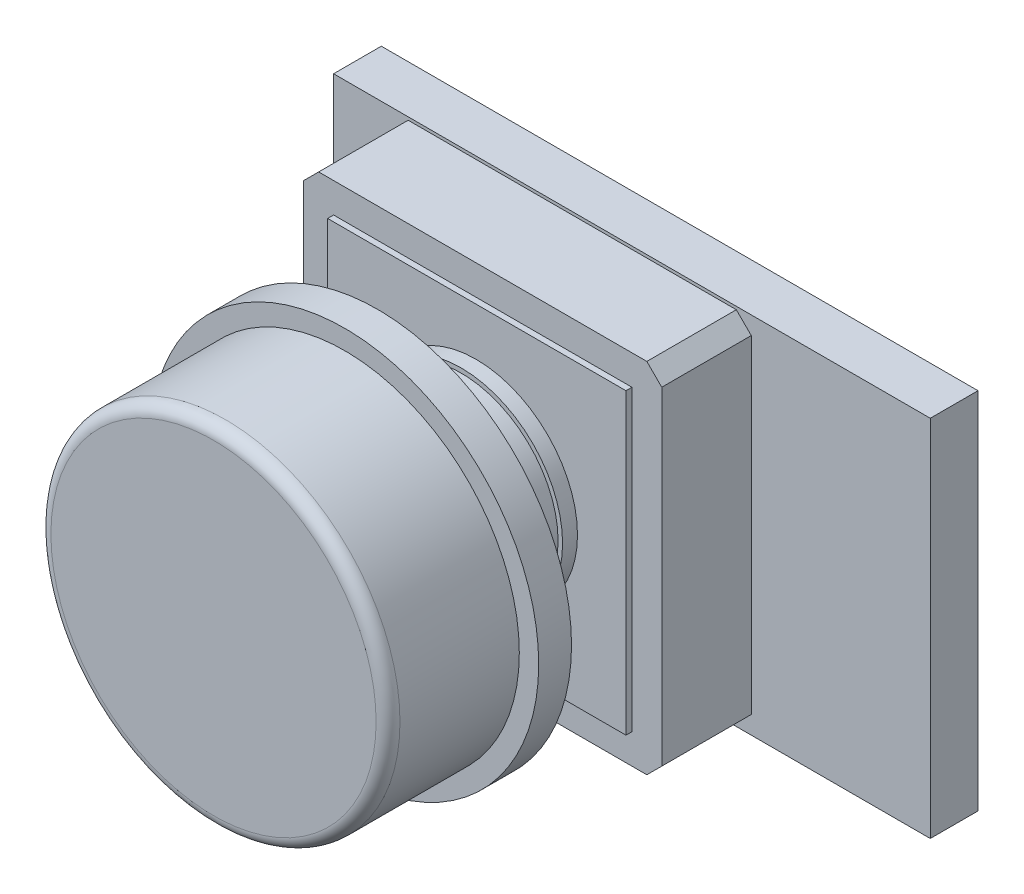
SolidWorks part; units mm, degrees
ref_plane "Top" through (0, 0, 0) normal (0, 0, 1) x (1, 0, 0)
ref_plane "Front" through (0, 0, 0) normal (0, 1, 0) x (1, 0, 0)
ref_plane "Side" through (0, 0, 0) normal (1, 0, 0) x (0, 0, -1)
sketch "Sketch1" plane through (0, 0, 0) normal (0, 0, 1) x (1, 0, 0)
  line L0 (0, 0) -> (7, 0) construction
  line L1 (-13, 6.1) -> (7, 6.1)
  line L2 (-13, 6.1) -> (-13, -6.1)
  line L3 (-13, -6.1) -> (7, -6.1)
  line L4 (7, 6.1) -> (7, -6.1)
  dimension "D1" = 7
  dimension "D2" = 12.2
  dimension "D4" = 20
extrude "Boss-Extrude1" add sketch "Sketch1" against normal blind 1.6
ref_plane "Plane1" through (0, 4, 0) normal (0, 1, 0) x (1, 0, 0)
ref_plane "Plane2" through (0, 5.27, 0) normal (0, 1, 0) x (1, 0, 0)
sketch "Esquisse1" plane through (0, 0, 0) normal (0, 0, 1) x (1, 0, 0)
  line L0 (0, 0) -> (-8.5641, 0) construction
  line L1 (-10.5, 6) -> (0.5, 6)
  line L2 (-11, 5.5) -> (-11, -5.5)
  line L3 (-10.5, -6) -> (0.5, -6)
  line L4 (1, 5.5) -> (1, -5.5)
  line L5 (-11, 6) -> (1, -6) construction
  line L6 (-11, -6) -> (1, 6) construction
  line L7 (7, -6.1) -> (7, 6.1) construction
  line L8 (-11, 5.5) -> (-10.5, 6)
  line L9 (0.5, 6) -> (1, 5.5)
  line L10 (0.5, -6) -> (1, -5.5)
  line L11 (-11, -5.5) -> (-10.5, -6)
  point P0 (-5, 0)
  dimension "D1" = 12
  dimension "D2" = 12
  dimension "D3" = 6
extrude "Boss.-Extru.1" add sketch "Esquisse1" along normal blind 3
sketch "Esquisse2" plane through (0, 0, 3) normal (0, 0, 1) x (1, 0, 0)
  line L0 (-11, 5.5) -> (-10.5, 6) construction
  line L1 (-10.5, 6) -> (0.5, 6) construction
  line L2 (0.5, 6) -> (1, 5.5) construction
  line L3 (1, 5.5) -> (1, -5.5) construction
  line L4 (1, -5.5) -> (0.5, -6) construction
  line L5 (0.5, -6) -> (-10.5, -6) construction
  line L6 (-10.5, -6) -> (-11, -5.5) construction
  line L7 (-11, -5.5) -> (-11, 5.5) construction
  line L8 (-10, 5) -> (-10, 5)
  line L9 (-10, 5) -> (0, 5)
  line L10 (0, 5) -> (0, 5)
  line L11 (0, 5) -> (0, -5)
  line L12 (0, -5) -> (0, -5)
  line L13 (0, -5) -> (-10, -5)
  line L14 (-10, -5) -> (-10, -5)
  line L15 (-10, -5) -> (-10, 5)
  dimension "D1" = 1
extrude "Boss.-Extru.2" add sketch "Esquisse2" along normal blind 0.2
sketch "Esquisse3" plane through (0, 0, 3.2) normal (0, 0, 1) x (1, 0, 0)
  circle A0 centre (-5.0244, 0) radius 3.4
  dimension "D1" = 6.8
extrude "Boss.-Extru.3" add sketch "Esquisse3" along normal blind 0.5
sketch "Esquisse4" plane through (0, 0, 0) normal (0, 1, 0) x (1, 0, 0)
  line L0 (-5.0244, -3.7) -> (-1.7744, -3.7)
  line L1 (-8.4244, -3.7) -> (-1.6244, -3.7) construction
  line L2 (-1.7744, -3.7) -> (-1.7744, -6.5)
  line L3 (-1.7744, -6.5) -> (1.4756, -6.5)
  line L4 (1.4756, -6.5) -> (1.4756, -7.6)
  line L5 (1.4756, -7.6) -> (0.8256, -7.6)
  line L6 (0.8256, -7.6) -> (0.8256, -11.6)
  line L7 (0.4256, -12) -> (-5.0244, -12)
  line L8 (-5.0244, -12) -> (-5.0244, -3.7)
  arc A0 (0.8256, -11.6) -> (0.4256, -12) centre (0.4256, -11.6) cw
  point P13 (0.8256, -12)
  dimension "D7" = 0.4
  dimension "D1" = 3.25
  dimension "D2" = 2.8
  dimension "D3" = 1.1
  dimension "D4" = 6.5
  dimension "D5" = 5.85
  dimension "D6" = 4.4
revolve "Révolution1" add sketch "Esquisse4" angle 360 about L8
sketch "Esquisse5" plane through (0, 0, -1.6) normal (0, 0, -1) x (-1, 0, 0)
  line L1 (-3.6543, 5.5026) -> (-1.6938, 5.5026)
  line L2 (-3.6543, 5.5026) -> (-3.6543, 4.3263)
  line L3 (-3.6543, 4.3263) -> (-1.6938, 4.3263)
  line L4 (-1.6938, 5.5026) -> (-1.6938, 4.3263)
extrude "Boss.-Extru.4" add sketch "Esquisse5" along normal blind 0.5
sketch "Esquisse6" plane through (0, 0, -1.6) normal (0, 0, -1) x (-1, 0, 0)
  text T0 "R1" font "Century Gothic" height 1
extrude "Boss.-Extru.5" add sketch "Esquisse6" along normal blind 0.1
